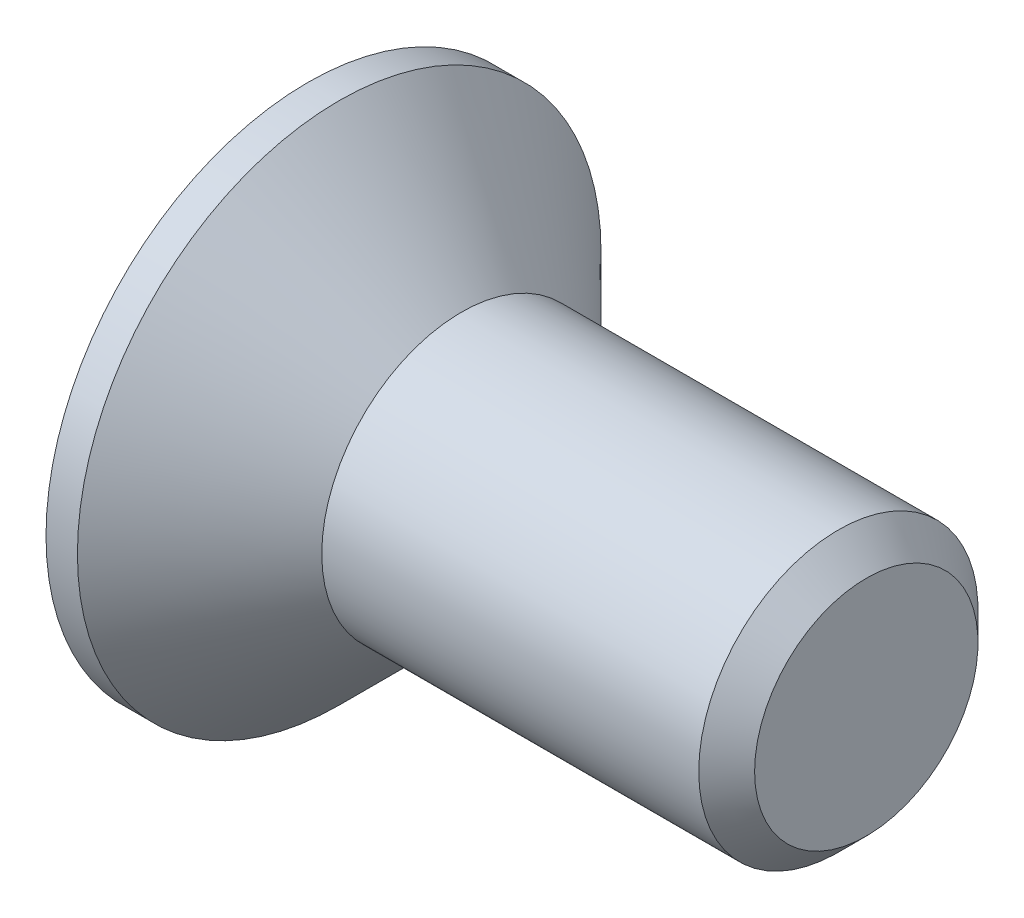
SolidWorks part; units mm, degrees
ref_plane "Front Plane" through (0, 0, 0) normal (0, 0, 1) x (1, 0, 0)
ref_plane "Top Plane" through (0, 0, 0) normal (0, 1, 0) x (1, 0, 0)
ref_plane "Right Plane" through (0, 0, 0) normal (1, 0, 0) x (0, 0, -1)
sketch "Sketch1" plane through (0, 0, 0) normal (0, 0, 1) x (1, 0, 0)
  line L1 (-2.2, 3.75) -> (-2.2, 0)
  line L2 (-2.2, 0) -> (5.8, 0)
  line L3 (5.8, 0) -> (5.8, 2)
  line L4 (5.8, 2) -> (0, 2)
  line L5 (-2.2, 3.75) -> (-1.75, 3.75)
  line L6 (-1.75, 3.75) -> (0, 2)
  dimension "D1" = 2
  dimension "D2" = 45
  dimension "D3" = 2.2
  dimension "D4" = 8
  dimension "D5" = 3.75
revolve "Revolve1" add sketch "Sketch1" angle 360 about L2
chamfer "Chamfer1" distance 0.4 angle 45 1 edges at (5.8, 0, 2)
sketch "Sketch2" plane through (-2.2, 0, 0) normal (-1, 0, 0) x (0, 0, 1)
  line L0 (-0.55, 2.2) -> (0.55, 2.2)
  line L1 (0.55, 2.2) -> (0.55, 0.55)
  line L2 (0.55, 0.55) -> (2.2, 0.55)
  line L3 (2.2, 0.55) -> (2.2, -0.55)
  line L4 (2.2, -0.55) -> (0.55, -0.55)
  line L5 (0.55, -0.55) -> (0.55, -2.2)
  line L6 (0.55, -2.2) -> (-0.55, -2.2)
  line L7 (-0.55, -2.2) -> (-0.55, -0.55)
  line L8 (-0.55, -0.55) -> (-2.2, -0.55)
  line L9 (-2.2, -0.55) -> (-2.2, 0.55)
  line L10 (-2.2, 0.55) -> (-0.55, 0.55)
  line L11 (-0.55, 0.55) -> (-0.55, 2.2)
  point P2 (0, 2.2)
  point P14 (0, -2.2)
  point P15 (2.2, 0)
  point P16 (-2.2, 0)
  dimension "D1" = 4.4
  dimension "D2" = 1.1
extrude "Cut-Extrude1" cut sketch "Sketch2" against normal blind 1.9
